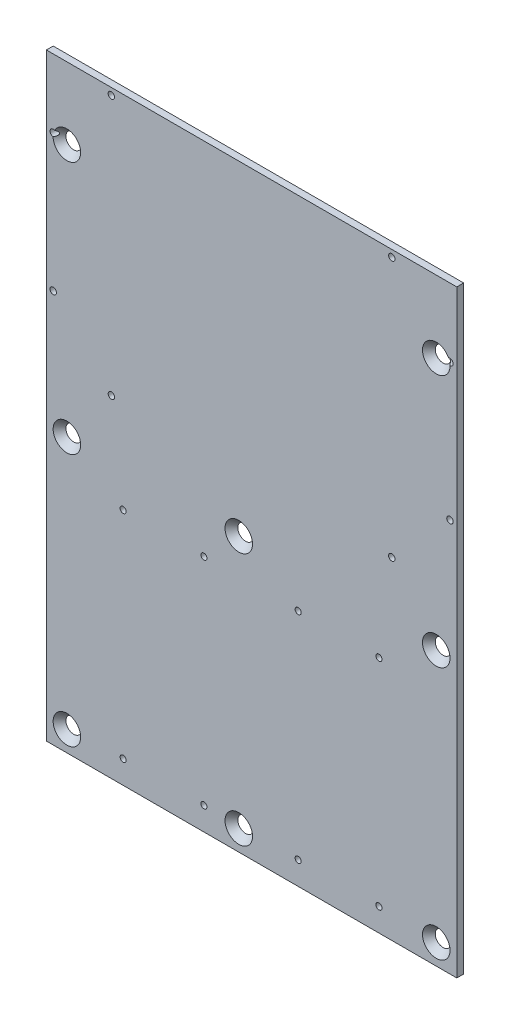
SolidWorks part; units mm, degrees
ref_plane "Front Plane" through (0, 0, 0) normal (0, 0, 1) x (1, 0, 0)
ref_plane "Top Plane" through (0, 0, 0) normal (0, 1, 0) x (1, 0, 0)
ref_plane "Right Plane" through (0, 0, 0) normal (1, 0, 0) x (0, 0, -1)
sketch "Sketch1" plane through (0, 0, 0) normal (0, 0, 1) x (1, 0, 0)
  line L1 (-76.2, -111.125) -> (76.2, -111.125)
  line L2 (-76.2, -111.125) -> (-76.2, 111.125)
  line L3 (-76.2, 111.125) -> (76.2, 111.125)
  line L4 (76.2, -111.125) -> (76.2, 111.125)
  line L5 (-76.2, -111.125) -> (76.2, 111.125) construction
  line L6 (-76.2, 111.125) -> (76.2, -111.125) construction
  point P0 (0, 0)
  dimension "D1" = 222.25
  dimension "D2" = 152.4
extrude "Boss-Extrude1" add sketch "Sketch1" along normal blind 2.54
hole_wizard "3/32 (0.09375) Diameter Hole1" positions "Sketch2" profile "Sketch3" hole size "3/32" standard "ANSI Inch"
sketch "Sketch2" plane through (0, 0, 2.54) normal (0, 0, 1) x (1, 0, 0)
  circle A0 centre (73.66, 85.725) radius 1.1906 construction
  circle A1 centre (52.07, 108.585) radius 1.1906 construction
  circle A2 centre (73.66, 34.925) radius 1.1906 construction
  circle A3 centre (52.07, 12.065) radius 1.1906 construction
  circle A4 centre (-52.07, 12.065) radius 1.1906 construction
  circle A5 centre (-73.66, 34.925) radius 1.1906 construction
  circle A6 centre (-73.66, 85.725) radius 1.1906 construction
  circle A7 centre (-52.07, 108.585) radius 1.1906 construction
  point P0 (52.07, 108.585)
  point P2 (73.66, 85.725)
  point P13 (73.66, 34.925)
  point P15 (52.07, 12.065)
  point P25 (-52.07, 12.065)
  point P27 (-73.66, 34.925)
  point P29 (-52.07, 108.585)
  point P31 (-73.66, 85.725)
sketch "Sketch3" plane through (52.07, 108.585, 2.54) normal (1, 0, 0) x (0, -1, 0)
  line L0 (0, 0) -> (0, 2.54)
  line L1 (0, 2.54) -> (1.1906, 2.54)
  line L2 (1.1906, 2.54) -> (1.1906, 0)
  line L5 (1.1906, 0) -> (0, 0)
  line L11 (0, -6.35) -> (0, 107.95) construction
  dimension "Thru Hole Dia." = 2.3812
  dimension "Thru Hole Depth" = 2.54
hole_wizard "#4-40 Tapped Hole1" positions "Sketch6" profile "Sketch7" tap size "#4-40" standard "ANSI Inch"
sketch "Sketch6" plane through (0, 0, 2.54) normal (0, 0, 1) x (1, 0, 0)
  circle A0 centre (47.3, -102.545) radius 1.6 construction
  circle A1 centre (17.3, -102.545) radius 1.6 construction
  circle A2 centre (-17.7, -102.545) radius 3.175 construction
  circle A3 centre (-47.7, -102.545) radius 1.5875 construction
  circle A4 centre (-47.7, -22.545) radius 1.6 construction
  circle A5 centre (-17.7, -22.545) radius 1.6 construction
  circle A6 centre (17.3, -22.545) radius 1.6 construction
  circle A7 centre (47.3, -22.545) radius 1.6 construction
  point P0 (47.3, -22.545)
  point P2 (-17.7, -22.545)
  point P4 (-47.7, -22.545)
  point P6 (17.3, -22.545)
  point P8 (47.3, -102.545)
  point P10 (17.3, -102.545)
  point P12 (-17.7, -102.545)
  point P14 (-47.7, -102.545)
sketch "Sketch7" plane through (47.3, -22.545, 2.54) normal (1, 0, 0) x (0, -1, 0)
  line L0 (0, 0) -> (0, 2.54)
  line L1 (0, 2.54) -> (1.1303, 2.54)
  line L2 (1.1303, 2.54) -> (1.1303, 0)
  line L5 (1.1303, 0) -> (0, 0)
  line L11 (0, -6.35) -> (0, 107.95) construction
  dimension "Thru Tap Drill Dia." = 2.2606
  dimension "Thru Tap Drill Depth" = 2.54
hole_wizard "CSK for #10 Flat Head Machine Screw1" positions "Sketch8" profile "Sketch9" countersink size "#10" standard "ANSI Inch"
sketch "Sketch8" plane through (0, 0, 2.54) normal (0, 0, 1) x (1, 0, 0)
  circle A0 centre (-68.58, 84.455) radius 1.7272 construction
  circle A1 centre (68.58, 84.455) radius 1.7272 construction
  circle A2 centre (-4.7498, -9.525) radius 1.7272 construction
  circle A3 centre (-68.58, -9.525) radius 1.7272 construction
  circle A4 centre (68.58, -9.525) radius 1.7272 construction
  circle A5 centre (-4.7498, -103.505) radius 1.7272 construction
  circle A6 centre (-68.58, -103.505) radius 1.7272 construction
  circle A7 centre (68.58, -103.505) radius 1.7272 construction
  point P0 (-4.7498, -103.505)
  point P2 (-68.58, -103.505)
  point P4 (68.58, -103.505)
  point P6 (-4.7498, -9.525)
  point P8 (-68.58, -9.525)
  point P10 (68.58, -9.525)
  point P12 (68.58, 84.455)
  point P14 (-68.58, 84.455)
sketch "Sketch9" plane through (-4.7498, -103.505, 2.54) normal (1, 0, 0) x (0, -1, 0)
  line L0 (0, 0) -> (0, 2.54)
  line L1 (0, 2.54) -> (2.5527, 2.54)
  line L2 (2.5527, 2.54) -> (2.5527, 2.9422)
  line L3 (2.5527, 2.9422) -> (5.1103, 0)
  line L5 (5.1103, 0) -> (0, 0)
  line L6 (-2.5527, 2.9422) -> (-5.1103, 0) construction
  line L11 (0, -6.35) -> (0, 107.95) construction
  dimension "Thru Hole Dia." = 5.1054
  dimension "Thru Hole Depth" = 2.54
  dimension "Near C'Sink Dia." = 10.2206
  dimension "Near C'Sink Angle" = 82
